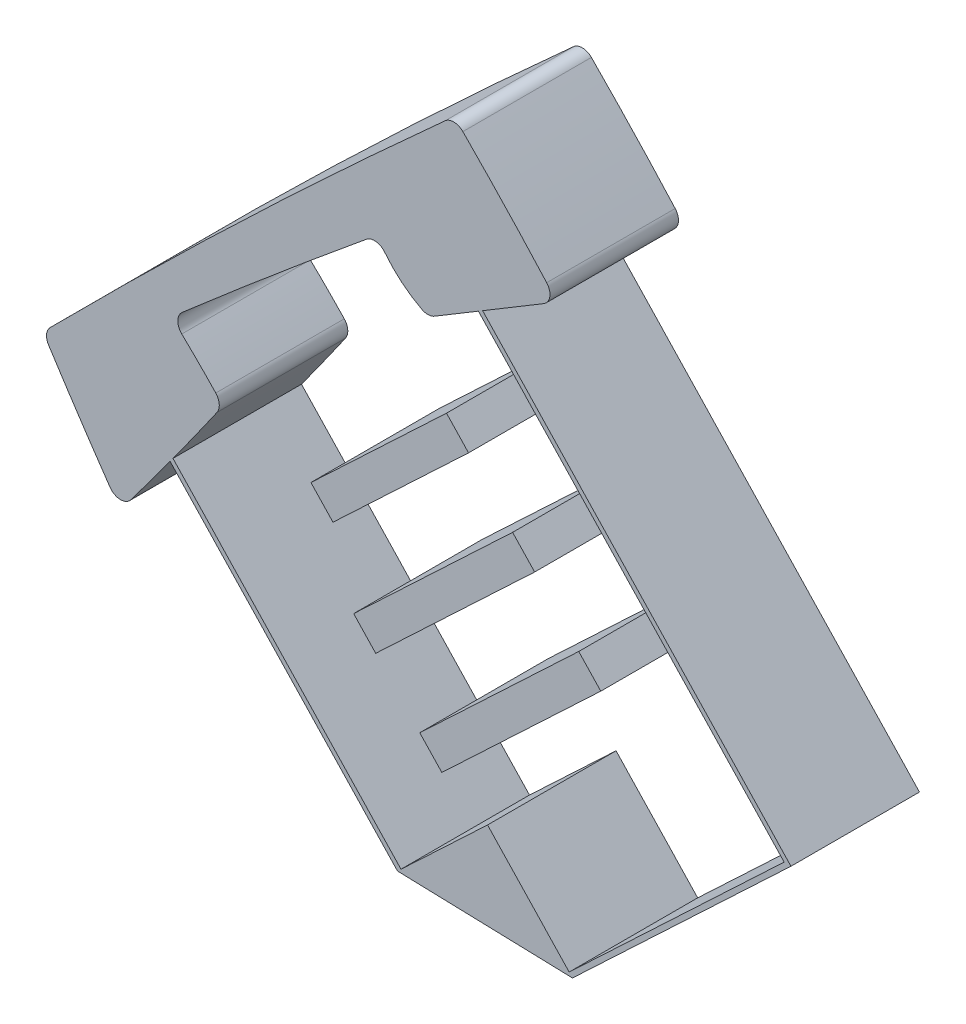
SolidWorks part; units mm, degrees
ref_plane "Ebene vorne" through (0, 0, 0) normal (0, 0, 1) x (1, 0, 0)
ref_plane "Ebene oben" through (0, 0, 0) normal (0, 1, 0) x (1, 0, 0)
ref_plane "Ebene rechts" through (0, 0, 0) normal (1, 0, 0) x (0, 0, -1)
sketch "Skizze1" plane through (0, 0, 0) normal (0, 0, 1) x (1, 0, 0)
  line L0 (0, 11.7087) -> (0, 0) construction
  line L1 (0, 0) -> (8.7585, 0) construction
  line L2 (2.8, 2.2) -> (1.2, 0) construction
  line L3 (2.8, 2.2) -> (2, 3) construction
  line L4 (2, 3) -> (5.2, 5.7) construction
  line L5 (5.2, 5.7) -> (6, 5) construction
  line L6 (1.2, 0) -> (0, 1.8) construction
  line L7 (6, 5) -> (8, 6.2)
  line L8 (8, 6.2) -> (6.4, 7.9) construction
  line L9 (0, 1.8) -> (6.4, 7.9) construction
  arc A0 (0, 1.8) -> (6.4, 7.9) centre (103.3183, -100.1922) cw
  arc A1 (1.2, 0) -> (0, 1.8) centre (41.5101, 28.1734) cw
  arc A2 (2.8, 2.2) -> (1.2, 0) centre (-45.9519, 35.9741) cw
  arc A3 (2.8, 2.2) -> (2, 3) centre (-8.5365, -8.3365) ccw
  arc A4 (2, 3) -> (5.2, 5.7) centre (88.7338, -96.5493) cw
  arc A5 (6, 5) -> (5.2, 5.7) centre (6.7205, 6.6306) cw
  arc A6 (8, 6.2) -> (6.4, 7.9) centre (-21.1376, -19.6206) ccw
  point P0 (1.2, 0)
  point P1 (2.8, 2.2)
  point P2 (2, 3)
  point P3 (6, 5)
  point P4 (5.2, 5.7)
  point P5 (8, 6.2)
  point P6 (6.4, 7.9)
  point P7 (0, 1.8)
  dimension "D1" = 1.2
  dimension "D2" = 2
  dimension "D3" = 3
  dimension "D4" = 2.8
  dimension "D5" = 2.2
  dimension "D6" = 5.2
  dimension "D7" = 5.7
  dimension "D8" = 5
  dimension "D9" = 6
  dimension "D10" = 1.8
  dimension "D11" = 8
  dimension "D12" = 6.2
  dimension "D13" = 7.9
  dimension "D14" = 6.4
extrude "Linear austragen1" add sketch "Skizze1" along normal blind 2
sketch "Skizze2" plane through (0, 0, 2) normal (0, 0, 1) x (1, 0, 0)
  line L0 (5.5165, -2.7101) -> (8.2401, -2.7902)
  line L2 (3.7827, 4.0127) -> (7.4438, 0.1298) construction
  line L3 (6.7424, 5.6112) -> (11.6406, 0.4161)
  line L4 (11.6406, 0.4161) -> (8.2401, -2.7902)
  line L5 (5.5165, -2.7101) -> (1.1745, 1.8951)
  line L6 (8.1886, -2.7356) -> (6.9184, -1.3883)
  line L7 (5.5711, -2.6586) -> (6.9184, -1.3883)
  line L8 (6.6766, 5.5716) -> (11.5346, 0.4192)
  line L9 (11.5346, 0.4192) -> (8.1886, -2.7356)
  line L10 (5.5711, -2.6586) -> (1.2621, 1.9116)
  line L13 (6.6766, 5.5716) -> (6.7424, 5.6112)
  line L16 (8.6807, 1.296) -> (6.2069, -1.0364)
  line L18 (6.2796, 3.8426) -> (6.6226, 3.4788)
  line L19 (8.3377, 1.6598) -> (5.8639, -0.6726)
  line L20 (7.6516, 2.3874) -> (5.1778, 0.055)
  line L21 (7.3086, 2.7512) -> (4.8348, 0.4188)
  line L22 (6.6226, 3.4788) -> (4.5126, 1.4893)
  line L23 (6.2796, 3.8426) -> (4.1696, 1.8531)
  line L24 (5.8639, -0.6726) -> (6.2069, -1.0364)
  line L26 (8.3377, 1.6598) -> (8.6807, 1.296)
  line L28 (7.3086, 2.7512) -> (7.6516, 2.3874)
  line L29 (4.8348, 0.4188) -> (5.1778, 0.055)
  line L30 (4.1696, 1.8531) -> (4.5126, 1.4893)
  arc A2 (1.1745, 1.8951) -> (1.2621, 1.9116) centre (1.0789, 2.6454) ccw
  point P0 (0, 0)
  point P20 (6.7335, 0.8831)
extrude "Linear austragen2" add sketch "Skizze2" against normal blind 2
fillet "Verrundung2" radius 0.2 8 edges at (6.4, 7.9, 1) (8, 6.2, 1) (6, 5, 1) (5.2, 5.7, 1) (2, 3, 1) (2.8, 2.2, 1) (0, 1.8, 1) (1.2, 0, 1)
